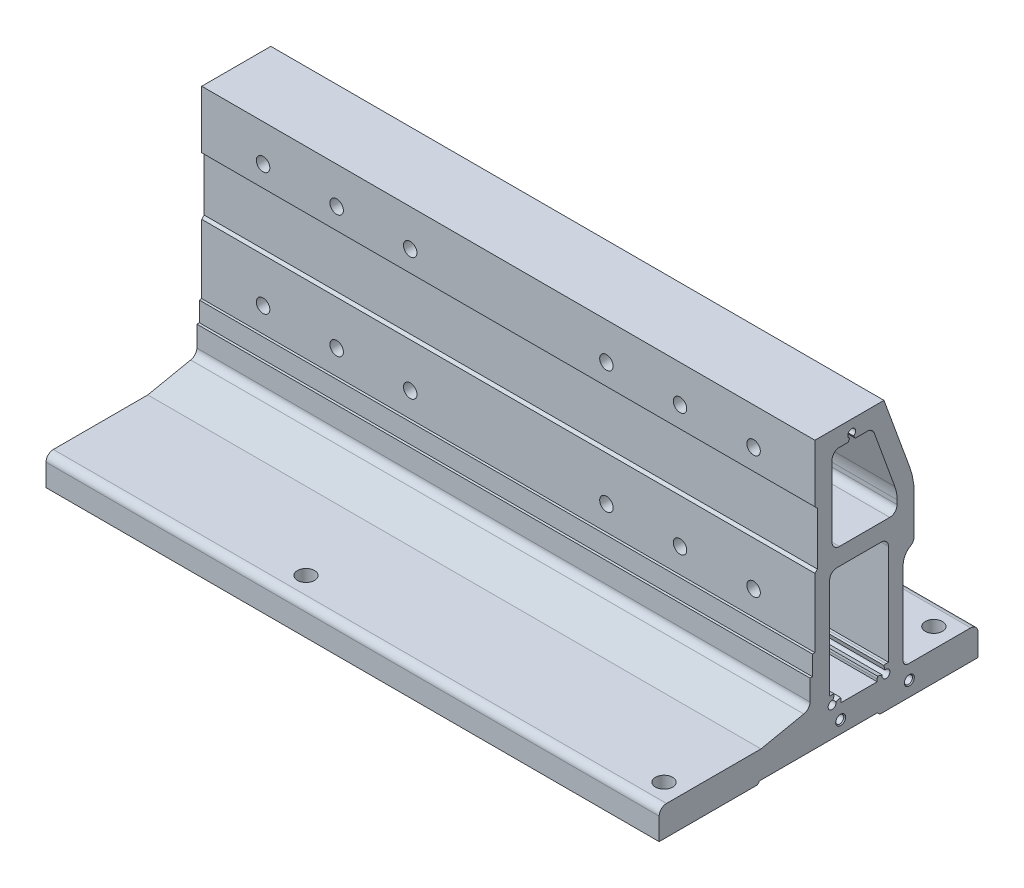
SolidWorks part; units mm, degrees
ref_plane "정면" through (0, 0, 0) normal (0, 0, 1) x (1, 0, 0)
ref_plane "윗면" through (0, 0, 0) normal (0, 1, 0) x (1, 0, 0)
ref_plane "우측면" through (0, 0, 0) normal (1, 0, 0) x (0, 0, -1)
sketch "스케치1" plane through (0, 0, 0) normal (1, 0, 0) x (0, 0, -1)
  line L0 (26.6655, 109) -> (-1.5, 109)
  line L1 (-1.5, 109) -> (-1.5, 85.5)
  line L2 (-1.5, 85.5) -> (-0.5, 84.5)
  line L3 (-0.5, 84.5) -> (-0.5, 63)
  line L4 (-0.5, 63) -> (-1.5, 62)
  line L5 (-1.5, 62) -> (-1.5, 34)
  line L6 (-1.5, 34) -> (-2.5, 34)
  line L7 (-2.5, 34) -> (-2.5, 26)
  line L8 (-2.5, 26) -> (-3.5, 26)
  line L9 (-3.5, 26) -> (-3.5, 17.5661)
  line L10 (-6.0351, 14.6023) -> (-23.5, 11)
  line L11 (-23.5, 11) -> (-62, 11)
  line L12 (-65, 8) -> (-65, -1)
  line L13 (-65, -1) -> (-25, -1)
  line L14 (-25, -1) -> (-24, 0)
  line L15 (-24, 0) -> (24, 0)
  line L16 (24, 0) -> (25, -1)
  line L17 (25, -1) -> (65, -1)
  line L18 (65, -1) -> (65, 8)
  line L19 (62, 11) -> (36.5, 11)
  line L20 (34.5, 13) -> (34.5, 47)
  line L21 (39, 54.7942) -> (39, 69.8213)
  line L22 (37.1908, 80.0819) -> (26.6655, 109)
  line L23 (25.5, 59.5) -> (7.5, 59.5)
  line L24 (4.5, 56.5) -> (4.5, 15.6)
  line L25 (4.5, 15.6) -> (5.5, 15.6)
  line L26 (6.4317, 15.4773) -> (5.9141, 13.5455)
  line L27 (7.0455, 12.4141) -> (8.9773, 12.9317)
  line L28 (9.1, 12) -> (9.1, 11)
  line L29 (9.1, 11) -> (23.9, 11)
  line L30 (23.9, 11) -> (23.9, 12)
  line L31 (24.0227, 12.9317) -> (25.9545, 12.4141)
  line L32 (27.0859, 13.5455) -> (26.5683, 15.4773)
  line L33 (27.5, 15.6) -> (28.5, 15.6)
  line L34 (28.5, 15.6) -> (28.5, 56.5)
  line L35 (12.7, 102.6144) -> (12.0566, 101.5)
  line L36 (12.0566, 101.5) -> (8.5, 101.5)
  line L37 (5.5, 98.5) -> (5.5, 69.5)
  line L38 (8.5, 66.5) -> (29, 66.5)
  line L39 (32, 69.5) -> (32, 71.2319)
  line L40 (31.0954, 76.3622) -> (22.6644, 99.5261)
  line L41 (19.8454, 101.5) -> (14.9434, 101.5)
  line L42 (14.9434, 101.5) -> (14.3, 102.6144)
  arc A0 (-6.0351, 14.6023) -> (-3.5, 17.5661) centre (-6.5, 17.5661) ccw
  arc A1 (-62, 11) -> (-65, 8) centre (-62, 8) ccw
  arc A2 (65, 8) -> (62, 11) centre (62, 8) ccw
  arc A3 (34.5, 13) -> (36.5, 11) centre (36.5, 13) ccw
  arc A4 (37.5, 52.1962) -> (34.5, 47) centre (40.5, 47) ccw
  arc A5 (37.5, 52.1962) -> (39, 54.7942) centre (36, 54.7942) ccw
  arc A6 (39, 69.8213) -> (37.1908, 80.0819) centre (9, 69.8213) ccw
  arc A7 (7.5, 59.5) -> (4.5, 56.5) centre (7.5, 56.5) ccw
  arc A8 (6.4317, 15.4773) -> (5.5, 15.6) centre (5.5, 12) ccw
  arc A9 (5.9141, 13.5455) -> (7.0455, 12.4141) centre (5.5, 12) ccw
  arc A10 (9.1, 12) -> (8.9773, 12.9317) centre (5.5, 12) ccw
  arc A11 (24.0227, 12.9317) -> (23.9, 12) centre (27.5, 12) ccw
  arc A12 (25.9545, 12.4141) -> (27.0859, 13.5455) centre (27.5, 12) ccw
  arc A13 (27.5, 15.6) -> (26.5683, 15.4773) centre (27.5, 12) ccw
  arc A14 (28.5, 56.5) -> (25.5, 59.5) centre (25.5, 56.5) ccw
  arc A15 (14.3, 102.6144) -> (12.7, 102.6144) centre (13.5, 104) ccw
  arc A16 (8.5, 101.5) -> (5.5, 98.5) centre (8.5, 98.5) ccw
  arc A17 (5.5, 69.5) -> (8.5, 66.5) centre (8.5, 69.5) ccw
  arc A18 (29, 66.5) -> (32, 69.5) centre (29, 69.5) ccw
  arc A19 (32, 71.2319) -> (31.0954, 76.3622) centre (17, 71.2319) ccw
  arc A20 (22.6644, 99.5261) -> (19.8454, 101.5) centre (19.8454, 98.5) ccw
extrude "보스-돌출1" add sketch "스케치1" along normal mid plane 250
hole_wizard "M5 소켓 머리 캡 나사용 카운터보어1" positions "스케치2" profile "스케치3" counterbore size "M5" standard "KS"
sketch "스케치2" plane through (0, 0, -39) normal (0, 0, -1) x (-1, 0, 0)
  line L0 (-125, -1) -> (125, -1) construction
  line L1 (-125, 80.0819) -> (-125, 109) construction
  point P0 (-100, 94)
  point P2 (-70, 94)
  point P4 (-40, 94)
  point P6 (-100, 44)
  point P8 (-70, 44)
  point P10 (-40, 44)
  dimension "D1" = 50
  dimension "D2" = 45
  dimension "D3" = 25
  dimension "D4" = 30
  dimension "D5" = 30
sketch "스케치3" plane through (100, 94, -39) normal (1, 0, 0) x (0, 1, 0)
  line L0 (0, 0) -> (0, 104)
  line L1 (0, 104) -> (2.75, 104)
  line L3 (2.75, 104) -> (2.75, 34.5)
  line L4 (2.75, 34.5) -> (4.75, 34.5)
  line L5 (4.75, 34.5) -> (4.75, 0)
  line L7 (4.75, 0) -> (0, 0)
  line L11 (0, -6.35) -> (0, 107.95) construction
  dimension "관통 구멍 지름" = 5.5
  dimension "관통 구멍 깊이" = 104
  dimension "카운터보어 지름" = 9.5
  dimension "카운터보어 깊이" = 34.5
pattern_linear "선형 패턴1" count 2 spacing 140 along (-1, 0, 0) of "M5 소켓 머리 캡 나사용 카운터보어1"
hole_wizard "M4 나사 구멍1" positions "스케치4" profile "스케치5" tap size "M4" standard "ISO"
sketch "스케치4" plane through (125, 0, 0) normal (1, 0, 0) x (0, 0, -1)
  line L0 (65, -1) -> (65, 8) construction
  line L1 (25, -1) -> (65, -1) construction
  point P0 (37, 5)
  point P2 (9, 5)
  dimension "D1" = 28
  dimension "D2" = 28
  dimension "D3" = 6
sketch "스케치5" plane through (125, 5, -37) normal (0, 1, 0) x (0, 0, -1)
  line L0 (0, 0) -> (0, 10.9914)
  line L1 (0, 10.9914) -> (1.65, 10)
  line L2 (1.65, 10) -> (1.65, 0.375)
  line L3 (1.65, 0.375) -> (2.025, 0)
  line L5 (2.025, 0) -> (0, 0)
  line L6 (-1.65, 0.375) -> (-2.025, 0) construction
  line L10 (0, 10.9914) -> (-1.65, 10) construction
  line L11 (0, -6.35) -> (0, 107.95) construction
  dimension "탭 드릴 지름" = 3.3
  dimension "탭 드릴 깊이" = 10
  dimension "표면 카운터싱크 지름" = 4.05
  dimension "표면 카운터싱크 각도" = 90
  dimension "드릴 각도" = 118
hole_wizard "Ø5.0mm 맞춤핀 구멍1" positions "스케치6" profile "스케치7" hole size "Ø5.0" standard "ISO"
sketch "스케치6" plane through (0, 0, 0) normal (0, -1, 0) x (-1, 0, 0)
  line L0 (0, 0) -> (-139.809, 0) construction
  line L1 (-125, -24) -> (-125, 24) construction
  point P6 (-117, 0)
  point P8 (29, 0)
  dimension "D1" = 8
  dimension "D2" = 146
sketch "스케치7" plane through (-29, 0, 0) normal (1, 0, 0) x (0, 0, -1)
  line L0 (0, 0) -> (0, 11.5022)
  line L1 (0, 11.5022) -> (2.5, 10)
  line L2 (2.5, 10) -> (2.5, 0)
  line L5 (2.5, 0) -> (0, 0)
  line L10 (0, 11.5022) -> (-2.5, 10) construction
  line L11 (0, -6.35) -> (0, 107.95) construction
  dimension "구멍 지름" = 5
  dimension "구멍 깊이" = 10
  dimension "드릴 각도" = 118
hole_wizard "Ø7.0 (7) 지름 구멍1" positions "스케치8" profile "스케치9" hole size "Ø7.0" standard "ISO"
sketch "스케치8" plane through (0, -1, 0) normal (0, -1, 0) x (-1, 0, 0)
  line L0 (-125, 25) -> (-125, 65) construction
  line L1 (-125, 65) -> (125, 65) construction
  point P0 (29, -55)
  point P2 (-117, -55)
  point P4 (29, 55)
  point P6 (-117, 55)
  dimension "D1" = 146
  dimension "D2" = 8
  dimension "D3" = 10
  dimension "D4" = 110
sketch "스케치9" plane through (-29, -1, 55) normal (1, 0, 0) x (0, 0, -1)
  line L0 (0, 0) -> (0, 110)
  line L1 (0, 110) -> (3.5, 110)
  line L2 (3.5, 110) -> (3.5, 0)
  line L5 (3.5, 0) -> (0, 0)
  line L11 (0, -6.35) -> (0, 107.95) construction
  dimension "관통 구멍 지름" = 7
  dimension "관통 구멍 깊이" = 110
